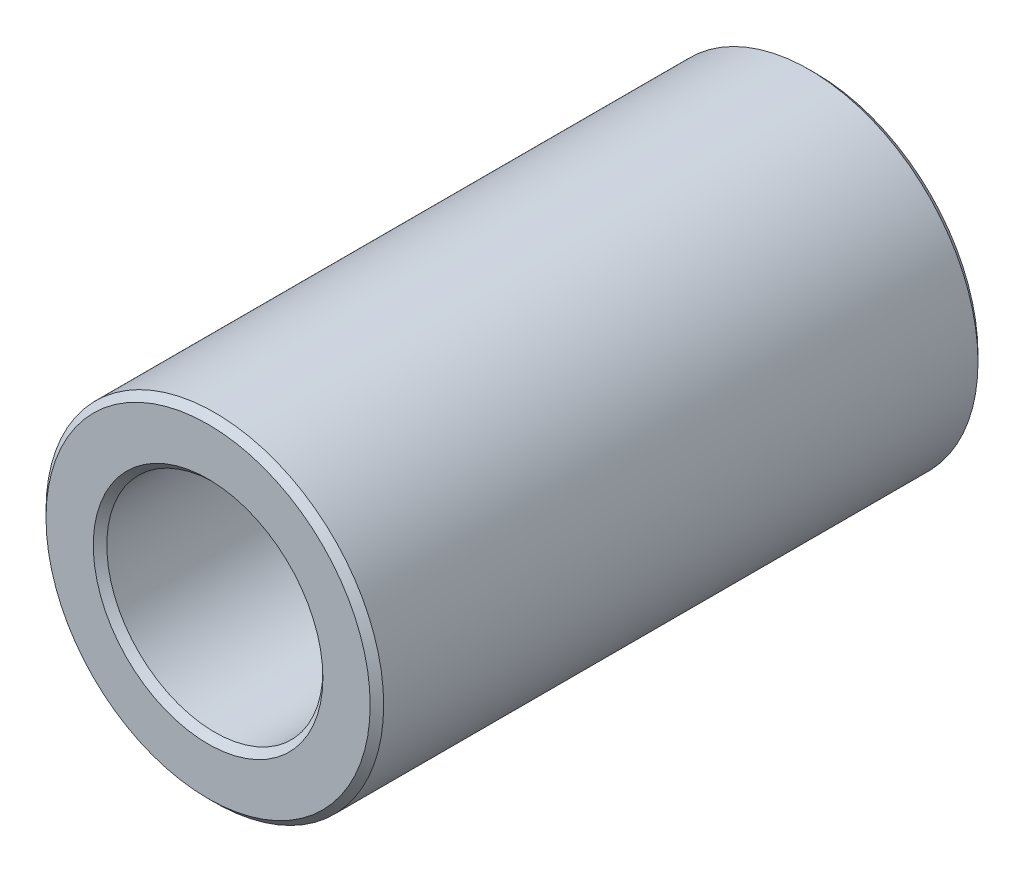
SolidWorks part; units mm, degrees
ref_plane "Front Plane" through (0, 0, 0) normal (0, 0, 1) x (1, 0, 0)
ref_plane "Top Plane" through (0, 0, 0) normal (0, 1, 0) x (1, 0, 0)
ref_plane "Right Plane" through (0, 0, 0) normal (1, 0, 0) x (0, 0, -1)
sketch "Sketch1" plane through (0, 0, 0) normal (0, 0, 1) x (1, 0, 0)
  circle A0 centre (0, 0) radius 5
  circle A1 centre (0, 0) radius 3.2
  dimension "D1" = 10
  dimension "D2" = 6.4
extrude "Boss-Extrude2" add sketch "Sketch1" along normal mid plane 18
chamfer "Chamfer3" distance 0.2 angle 45 4 edges at (5, 0, 9) (5, 0, -9) (3.2, 0, -9) (3.2, 0, 9)
